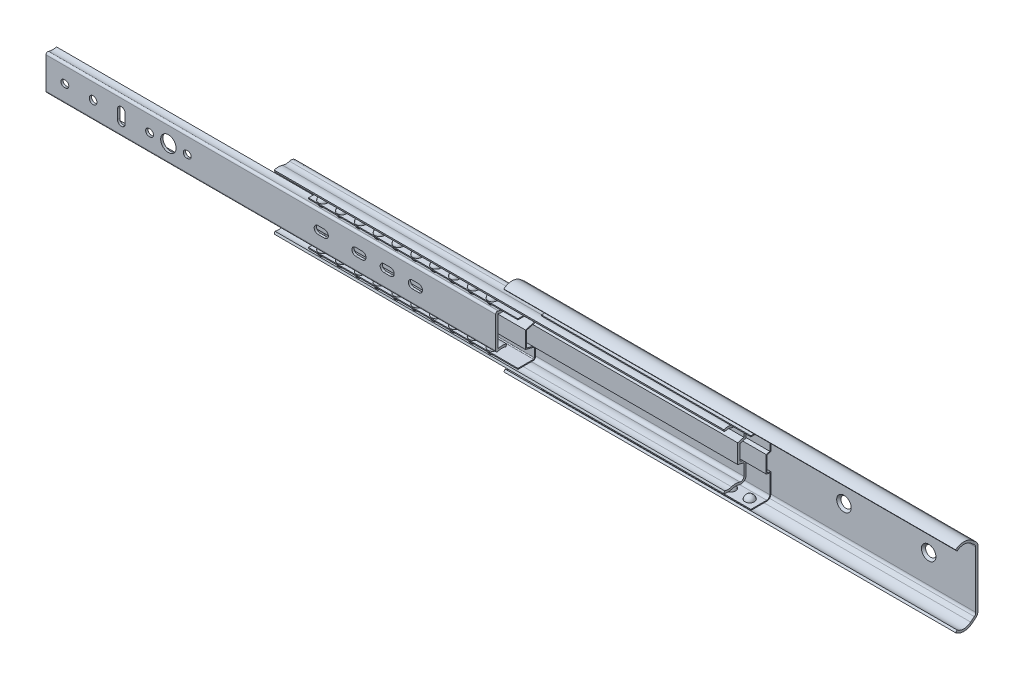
SolidWorks part; units mm, degrees
ref_plane "Front" through (0, 0, 0) normal (0, 0, 1) x (1, 0, 0)
ref_plane "Top" through (0, 0, 0) normal (0, 1, 0) x (1, 0, 0)
ref_plane "Right" through (0, 0, 0) normal (1, 0, 0) x (0, 0, -1)
sketch "Sketch1" plane through (0, 0, 0) normal (1, 0, 0) x (0, 0, -1)
  line L0 (9.525, -19.05) -> (9.525, 19.05)
  line L1 (9.525, 0) -> (-9.525, 0) construction
  line L2 (0, 0) -> (0, -26.1938) construction
  line L3 (5.5563, -24.2193) -> (8.0193, -22.2158)
  line L4 (8.001, -19.05) -> (8.001, 19.05)
  line L5 (4.5946, -23.037) -> (7.0576, -21.0335)
  line L6 (-5.5562, -24.2193) -> (-4.5946, -23.037)
  line L7 (5.5563, 24.2193) -> (8.0193, 22.2158)
  line L8 (-5.5563, 24.2193) -> (-4.5946, 23.037)
  line L9 (4.5946, 23.037) -> (7.0576, 21.0335)
  arc A0 (5.5563, -24.2193) -> (-5.5562, -24.2193) centre (0, -17.3887) cw
  arc A1 (8.0193, -22.2158) -> (9.525, -19.05) centre (5.4441, -19.05) ccw
  arc A2 (7.0576, -21.0335) -> (8.001, -19.05) centre (5.4441, -19.05) ccw
  arc A3 (4.5946, -23.037) -> (-4.5946, -23.037) centre (0, -17.3887) cw
  arc A4 (8.0193, 22.2158) -> (9.525, 19.05) centre (5.4441, 19.05) cw
  arc A5 (5.5563, 24.2193) -> (-5.5563, 24.2193) centre (0, 17.3887) ccw
  arc A6 (4.5946, 23.037) -> (-4.5946, 23.037) centre (0, 17.3887) ccw
  arc A7 (7.0576, 21.0335) -> (8.001, 19.05) centre (5.4441, 19.05) cw
  circle A8 centre (0, -21.4947) radius 3.175 construction
  point P27 (8.001, 0)
  point P29 (-9.525, 0)
  dimension "D2" = 19.05
  dimension "D7" = 11.1125
  dimension "D8" = 3.175
  dimension "D6" = 1.524
  dimension "D4" = 15.0812
  dimension "D5" = 6.35
  dimension "D1" = 38.1
  dimension "D3" = 52.3875
extrude "Extrude1" add sketch "Sketch1" along normal mid plane 304.8
ref_plane "Travel 1" through (14.2875, 0, 0) normal (1, 0, 0) x (0, 0, -1)
sketch "Sketch2" plane through (14.2875, 0, 0) normal (1, 0, 0) x (0, 0, -1)
  line L0 (4.5946, -23.037) -> (7.0576, -21.0335) construction
  line L1 (-5.5562, -21.8249) -> (7.874, -21.8249) construction
  line L2 (7.874, -21.8249) -> (7.874, -5.8433) construction
  line L3 (7.2136, -19.0492) -> (7.2136, -6.35)
  line L4 (7.874, -5.8433) -> (5.4229, -5.1865)
  line L5 (5.4229, -5.1865) -> (5.4229, 0)
  line L6 (9.525, 0) -> (-9.525, 0) construction
  line L7 (5.4229, 0) -> (5.4229, 5.1865)
  line L8 (5.4229, 5.1865) -> (7.874, 5.8433)
  line L9 (9.525, 0) -> (-9.525, 0) construction
  line L10 (8.001, -19.05) -> (8.001, 19.05) construction
  line L11 (7.874, -19.0492) -> (7.874, -5.8433)
  line L12 (5.0983, -21.825) -> (-5.5562, -21.8249)
  line L13 (4.7625, -5.6932) -> (4.7625, 0)
  line L14 (7.2136, -6.35) -> (4.7625, -5.6932)
  line L15 (7.874, 5.8433) -> (7.874, 19.0492)
  line L16 (4.7625, 0) -> (4.7625, 5.6932)
  line L17 (-5.5562, -21.8249) -> (-5.5562, -21.1646)
  line L18 (5.7825, -21.1646) -> (-5.5562, -21.1646) construction
  line L19 (7.2136, -19.7334) -> (7.2136, -6.35) construction
  line L20 (4.7625, 5.6932) -> (7.2136, 6.35)
  line L21 (7.2136, 6.35) -> (7.2136, 19.0492)
  line L22 (-5.5562, -21.1646) -> (5.0983, -21.1646)
  line L23 (-5.5562, 21.1646) -> (-5.5562, 21.8249)
  line L24 (-5.5562, 21.8249) -> (5.0983, 21.825)
  line L25 (-5.5562, 21.1646) -> (5.0983, 21.1646)
  line L27 (9.525, -19.05) -> (9.525, 19.05) construction
  arc A0 (5.0983, -21.825) -> (7.874, -19.0492) centre (5.0983, -19.0492) ccw
  arc A1 (5.0983, -21.1646) -> (7.2136, -19.0492) centre (5.0983, -19.0492) ccw
  arc A3 (7.2136, -19.7334) -> (5.7825, -21.1646) centre (7.5939, -21.5448) cw construction
  arc A4 (7.874, -19.0492) -> (5.0983, -21.825) centre (7.5939, -21.5448) cw construction
  arc A5 (7.874, 19.0492) -> (5.0983, 21.825) centre (5.0983, 19.0492) ccw
  arc A6 (7.2136, 19.0492) -> (5.0983, 21.1646) centre (5.0983, 19.0492) ccw
  dimension "D1" = 75
  dimension "D2" = 0.127
  dimension "D3" = 0.3302
  dimension "D6" = 12.7
  dimension "D4" = 0.6604
  dimension "D5" = 75
  dimension "D7" = 4.7625
extrude "Extrude2" add sketch "Sketch2" against normal blind 141.2875 separate body
ref_plane "Travel 2" through (-304.8, 0, 0) normal (-1, 0, 0) x (0, 0, 1)
sketch "Sketch3" plane through (-304.8, 0, 0) normal (-1, 0, 0) x (0, 0, 1)
  line L0 (8.001, -18.7062) -> (7.5111, -17.263)
  line L1 (-7.2136, -6.35) -> (-4.7625, -5.6932) construction
  line L3 (-7.2136, -19.0492) -> (-7.2136, -6.35) construction
  line L4 (-7.0866, -15.3051) -> (-7.0866, -6.316)
  line L6 (-7.0866, -6.316) -> (-2.8713, -5.1865)
  line L7 (-2.8713, -5.1865) -> (-2.8713, 5.1865)
  line L8 (-9.525, 0) -> (9.525, 0) construction
  line L9 (-1.3473, 6.3559) -> (-1.3473, -6.3559)
  line L10 (-1.3473, -6.3559) -> (-5.5626, -7.4854)
  line L11 (-5.5626, -7.4854) -> (-5.5626, -15.3051)
  line L13 (7.5111, 17.263) -> (8.001, 18.7062)
  line L15 (9.525, 0) -> (-9.525, 0) construction
  line L16 (-7.0866, 6.316) -> (-2.8713, 5.1865)
  line L17 (-7.0866, 15.3051) -> (-7.0866, 6.316)
  line L21 (-5.5626, 7.4854) -> (-5.5626, 15.3051)
  line L22 (-1.3473, 6.3559) -> (-5.5626, 7.4854)
  line L23 (5.5562, -21.4947) -> (9.525, -21.4947) construction
  line L24 (5.5562, -21.8249) -> (5.5562, -21.1646) construction
  line L25 (9.525, -21.4947) -> (9.525, 0) construction
  line L27 (0, 0) -> (0, -26.1938) construction
  arc A0 (2.8303, -17.263) -> (-2.8303, -17.263) centre (0, -25.6008) ccw
  arc A1 (-2.3404, -18.7062) -> (2.3404, -18.7062) centre (0, -25.6008) cw
  circle A2 centre (0, -21.4947) radius 3.175 construction
  arc A6 (2.8303, -17.263) -> (7.5111, -17.263) centre (5.1707, -10.3684) ccw
  arc A8 (2.3404, -18.7062) -> (8.001, -18.7062) centre (5.1707, -10.3684) ccw
  arc A9 (-2.3404, -18.7062) -> (-7.0866, -15.3051) centre (-3.4949, -15.3051) cw
  arc A10 (-4.5946, -23.037) -> (4.5946, -23.037) centre (0, -17.3887) ccw construction
  arc A11 (-2.8303, -17.263) -> (-5.5626, -15.3051) centre (-3.4949, -15.3051) cw
  arc A12 (-2.3404, 18.7062) -> (-7.0866, 15.3051) centre (-3.4949, 15.3051) ccw
  arc A13 (-2.3404, 18.7062) -> (2.3404, 18.7062) centre (0, 25.6008) ccw
  arc A14 (2.8303, 17.263) -> (7.5111, 17.263) centre (5.1707, 10.3684) cw
  arc A15 (2.3404, 18.7062) -> (8.001, 18.7062) centre (5.1707, 10.3684) cw
  arc A18 (2.8303, 17.263) -> (-2.8303, 17.263) centre (0, 25.6008) cw
  arc A19 (-2.8303, 17.263) -> (-5.5626, 15.3051) centre (-3.4949, 15.3051) ccw
  circle A20 centre (5.1707, -14.4744) radius 3.175 construction
  point P47 (-2.8713, 0)
  point P67 (-1.3473, 0)
  point P72 (7.5406, -21.4947)
  dimension "D1" = 1.524
  dimension "D4" = 1.524
  dimension "D2" = 1.524
  dimension "D3" = 1.524
  dimension "D6" = 0.127
extrude "Extrude3" add sketch "Sketch3" against normal blind 303.276 separate body
ref_plane "Travel 3" through (-139.6365, 0, 0) normal (1, 0, 0) x (0, 0, -1)
sketch "Sketch9" plane through (-139.6365, 0, 0) normal (-1, 0, 0) x (0, 0, 1)
  line L0 (8.763, -14.1442) -> (-1.7526, -14.1442)
  line L1 (-2.3622, -13.5346) -> (-2.3622, -7.3115)
  line L2 (-2.3622, -7.3115) -> (3.6774, -5.6932)
  line L3 (9.525, -21.4947) -> (9.525, 0) construction
  line L4 (3.6774, -5.6932) -> (3.6774, 5.6932)
  line L5 (-5.5626, -7.4854) -> (-5.5626, -15.3051) construction
  line L6 (3.017, 5.1865) -> (3.017, -5.1865)
  line L7 (-1.3473, -6.3559) -> (-5.5626, -7.4854) construction
  line L9 (-1.7526, 14.8046) -> (8.763, 14.8046)
  line L10 (3.017, -5.1865) -> (-3.0226, -6.8048)
  line L11 (9.525, 0) -> (-9.525, 0) construction
  line L12 (-3.0226, -6.8048) -> (-3.0226, -13.5346)
  line L14 (8.763, -14.1442) -> (8.763, -14.8046)
  line L15 (8.763, -14.8046) -> (-1.7526, -14.8046)
  line L16 (5.5562, -21.8249) -> (5.5562, -21.1646) construction
  line L18 (8.763, 14.8046) -> (8.763, 14.1442)
  line L19 (-3.0226, 6.8048) -> (-3.0226, 13.5346)
  line L20 (3.017, 5.1865) -> (-3.0226, 6.8048)
  line L21 (-2.3622, 7.3115) -> (3.6774, 5.6932)
  line L22 (8.763, 14.1442) -> (-1.7526, 14.1442)
  line L23 (-2.3622, 7.3115) -> (-2.3622, 13.5346)
  arc A0 (-1.7526, -14.8046) -> (-3.0226, -13.5346) centre (-1.7526, -13.5346) cw
  arc A1 (-1.7526, -14.1442) -> (-2.3622, -13.5346) centre (-1.7526, -13.5346) cw
  arc A2 (-3.0226, 13.5346) -> (-1.7526, 14.8046) centre (-1.7526, 13.5346) cw
  arc A3 (-2.3622, 13.5346) -> (-1.7526, 14.1442) centre (-1.7526, 13.5346) cw
  point P19 (8.763, -14.4744)
  point P31 (-1.3473, 0)
  point P32 (3.6774, 0)
  dimension "D6" = 1.27
  dimension "D1" = 0.6604
  dimension "D2" = 0.6604
  dimension "D3" = 0.6604
  dimension "D4" = 0.762
  dimension "D5" = 2.54
extrude "Extrude5" add sketch "Sketch9" along normal blind 141.2875 separate body
ref_plane "Travel 4" through (-457.2, 0, 0) normal (-1, 0, 0) x (0, 0, 1)
sketch "Sketch10" plane through (-457.2, 0, 0) normal (1, 0, 0) x (0, 0, -1)
  line L0 (-9.525, -10.6051) -> (-9.525, 10.6051)
  line L1 (-9.525, -21.4947) -> (-9.525, 0) construction
  line L2 (9.525, 0) -> (-9.525, 0) construction
  line L3 (-8.001, 10.2427) -> (-8.001, -10.2427)
  line L4 (-2.5445, -11.7896) -> (-1.9948, -10.3681)
  line L6 (-2.5445, 11.7896) -> (-1.9948, 10.3681)
  line L20 (-9.525, 0) -> (9.525, 0) construction
  arc A0 (-2.5445, -11.7896) -> (-7.7969, -11.7896) centre (-5.1707, -18.5805) ccw
  arc A1 (-7.7969, -11.7896) -> (-9.525, -10.6051) centre (-8.255, -10.6051) cw
  circle A2 centre (-5.1707, -14.4744) radius 3.175 construction
  arc A4 (-7.5111, -17.263) -> (-2.8303, -17.263) centre (-5.1707, -10.3684) ccw construction
  arc A7 (-1.9948, -10.3681) -> (-8.001, -10.2427) centre (-5.1707, -18.5805) ccw
  arc A8 (-7.7969, 11.7896) -> (-9.525, 10.6051) centre (-8.255, 10.6051) ccw
  arc A9 (-2.5445, 11.7896) -> (-7.7969, 11.7896) centre (-5.1707, 18.5805) cw
  arc A10 (-1.9948, 10.3681) -> (-8.001, 10.2427) centre (-5.1707, 18.5805) cw
  point P23 (-9.525, 0)
  point P29 (-8.001, 0)
  dimension "D3" = 1.524
  dimension "D4" = 1.27
  dimension "D1" = 1.524
  dimension "D2" = 1.524
extrude "Extrude6" add sketch "Sketch10" along normal blind 303.276 separate body
sketch "Sketch5" plane through (0, 0, -9.525) normal (0, 0, -1) x (-1, 0, 0)
  line L0 (-152.4, 0) -> (152.4, 0) construction
  line L1 (-152.4, -19.05) -> (-152.4, 19.05) construction
  line L11 (152.4, -19.05) -> (152.4, 19.05) construction
  circle A8 centre (146.05, 0) radius 2.5781
  circle A18 centre (120.65, 0) radius 2.5781
  point P0 (-63.5, 0)
  point P1 (-120.65, 0)
  point P39 (63.5, 0)
  dimension "D1" = 5.1562
  dimension "D2" = 6.35
  dimension "D3" = 25.4
  dimension "D4" = 82.55
  dimension "H" = 209.55
  dimension "J" = 266.7
extrude "Cut-Extrude1" cut sketch "Sketch5" against normal through all
hole_wizard "CSK for #10 Flat Head Machine Screw1" positions "Sketch14" profile "Sketch13" countersink size "#10" standard "Ansi Inch"
sketch "Sketch14" plane through (0, 0, -8.001) normal (0, 0, 1) x (1, 0, 0)
  point P0 (120.65, 0)
  point P4 (63.5, 0)
  point P7 (-63.5, 0)
sketch "Sketch13" plane through (120.65, 0, -8.001) normal (1, 0, 0) x (0, -1, 0)
  line L0 (0, 0) -> (0, 1.524)
  line L1 (0, 1.524) -> (3.048, 1.524)
  line L2 (3.048, 1.524) -> (3.048, 2.1184)
  line L3 (3.048, 2.1184) -> (4.8895, 0)
  line L5 (4.8895, 0) -> (0, 0)
  line L6 (-3.048, 2.1184) -> (-4.8895, 0) construction
  line L11 (0, -6.35) -> (0, 107.95) construction
  dimension "Thru Hole Dia." = 6.096
  dimension "Thru Hole Depth" = 1.524
  dimension "Near C'Sink Dia." = 9.779
  dimension "Near C'Sink Angle" = 82
sketch "Sketch6" plane through (0, 0, 8.001) normal (0, 0, -1) x (-1, 0, 0)
  line L0 (457.2, 0) -> (152.4, 0) construction
  line L1 (387.731, -2.286) -> (386.969, -2.286)
  line L2 (387.731, 2.286) -> (386.969, 2.286)
  line L3 (364.617, 0) -> (359.283, 0) construction
  line L4 (390.017, 0) -> (384.683, 0) construction
  line L5 (387.35, -2.286) -> (387.35, 2.286) construction
  line L6 (361.95, -2.286) -> (361.95, 2.286) construction
  line L9 (276.2885, 0) -> (266.7635, 0) construction
  line L11 (457.2, -10.2427) -> (457.2, 10.2427) construction
  line L17 (406.4, -5.7531) -> (406.4, 5.7531) construction
  line L19 (273.7096, -2.5789) -> (269.3424, -2.5789)
  line L20 (273.7096, 2.5789) -> (269.3424, 2.5789)
  line L21 (271.526, -2.5789) -> (271.526, 2.5789) construction
  line L22 (248.3096, -2.5789) -> (243.9424, -2.5789)
  line L23 (444.5, -2.286) -> (444.5, 2.286) construction
  line L24 (447.167, 0) -> (441.833, 0) construction
  line L25 (444.881, -2.286) -> (444.119, -2.286)
  line L26 (444.881, 2.286) -> (444.119, 2.286)
  line L27 (248.3096, 2.5789) -> (243.9424, 2.5789)
  line L28 (246.126, -2.5789) -> (246.126, 2.5789) construction
  line L29 (229.2596, -2.5789) -> (224.8924, -2.5789)
  line L30 (362.331, -2.286) -> (361.569, -2.286)
  line L31 (362.331, 2.286) -> (361.569, 2.286)
  line L32 (229.2596, 2.5789) -> (224.8924, 2.5789)
  line L33 (227.076, -2.5789) -> (227.076, 2.5789) construction
  line L34 (408.9781, -3.175) -> (408.9781, 3.175)
  line L35 (403.8219, -3.175) -> (403.8219, 3.175)
  line L36 (210.2096, -2.5789) -> (205.8424, -2.5789)
  line L37 (210.2096, 2.5789) -> (205.8424, 2.5789)
  line L38 (208.026, -2.5789) -> (208.026, 2.5789) construction
  arc A0 (444.881, -2.286) -> (444.881, 2.286) centre (444.881, 0) ccw
  arc A1 (387.731, -2.286) -> (387.731, 2.286) centre (387.731, 0) ccw
  arc A2 (386.969, -2.286) -> (386.969, 2.286) centre (386.969, 0) cw
  arc A3 (362.331, -2.286) -> (362.331, 2.286) centre (362.331, 0) ccw
  circle A6 centre (374.65, 0) radius 5.207
  arc A9 (408.9781, -3.175) -> (403.8219, -3.175) centre (406.4, -3.175) cw
  circle A10 centre (425.45, 0) radius 2.5781
  arc A12 (444.119, -2.286) -> (444.119, 2.286) centre (444.119, 0) cw
  arc A13 (361.569, -2.286) -> (361.569, 2.286) centre (361.569, 0) cw
  arc A14 (408.9781, 3.175) -> (403.8219, 3.175) centre (406.4, 3.175) ccw
  arc A16 (273.7096, -2.5789) -> (273.7096, 2.5789) centre (273.7096, 0) ccw
  arc A17 (269.3424, -2.5789) -> (269.3424, 2.5789) centre (269.3424, 0) cw
  arc A18 (248.3096, -2.5789) -> (248.3096, 2.5789) centre (248.3096, 0) ccw
  arc A19 (243.9424, -2.5789) -> (243.9424, 2.5789) centre (243.9424, 0) cw
  arc A20 (229.2596, -2.5789) -> (229.2596, 2.5789) centre (229.2596, 0) ccw
  arc A21 (224.8924, -2.5789) -> (224.8924, 2.5789) centre (224.8924, 0) cw
  arc A22 (210.2096, -2.5789) -> (210.2096, 2.5789) centre (210.2096, 0) ccw
  arc A23 (205.8424, -2.5789) -> (205.8424, 2.5789) centre (205.8424, 0) cw
  point P6 (387.35, 0)
  point P51 (406.4, 0)
  point P67 (444.5, 0)
  point P76 (361.95, 0)
  dimension "D1" = 5.1562
  dimension "D10" = 10.414
  dimension "D2" = 4.572
  dimension "D3" = 5.334
  dimension "D4" = 12.7
  dimension "D5" = 31.75
  dimension "D6" = 11.5062
  dimension "D" = 153.924
  dimension "E" = 179.324
  dimension "D7" = 5.1562
  dimension "D8" = 19.05
  dimension "D9" = 38.1
  dimension "D11" = 50.8
  dimension "D12" = 63.5
  dimension "D13" = 9.525
  dimension "D14" = 5.1579
  dimension "F" = 198.374
  dimension "G" = 217.424
extrude "Cut-Extrude2" cut sketch "Sketch6" against normal through all
ref_plane "Plane1" through (7.9375, 0, 0) normal (1, 0, 0) x (0, 0, -1)
sketch "Sketch8" plane through (7.9375, 0, 0) normal (1, 0, 0) x (0, 0, -1)
  line L0 (-3.175, -21.4947) -> (3.175, -21.4947)
  circle A0 centre (0, -21.4947) radius 3.175 construction
  arc A1 (-3.175, -21.4947) -> (3.175, -21.4947) centre (0, -21.4947) ccw
revolve "Revolve1" add sketch "Sketch8" angle 360 about L0
pattern_linear "LPattern2" count 10 spacing 12.7 along (-1, 0, 0) of "Revolve1"
mirror "Mirror2" about plane through (0, 0, 0) normal (0, 1, 0) of "LPattern2", "Revolve1"
ref_plane "Plane2" through (-274.574, 0, 0) normal (-1, 0, 0) x (0, 0, 1)
sketch "Sketch12" plane through (-274.574, 0, 0) normal (-1, 0, 0) x (0, 0, 1)
  line L0 (8.3457, -14.4744) -> (1.9957, -14.4744)
  circle A0 centre (5.1707, -14.4744) radius 3.175 construction
  arc A2 (8.3457, -14.4744) -> (1.9957, -14.4744) centre (5.1707, -14.4744) ccw
  circle A3 centre (5.1707, -14.4744) radius 3.175 construction
revolve "Revolve2" add sketch "Sketch12" angle 360 about L0
pattern_linear "LPattern3" count 10 spacing 12.7 along (1, 0, 0) of "Revolve2"
mirror "Mirror3" about plane through (0, 0, 0) normal (0, 1, 0) of "LPattern3", "Revolve2"
equation "\"D1@Extrude3\" = \"D1@Extrude1\"-0.06"
equation "\"D1@Extrude5\" = \"D1@Extrude2\""
equation "\"D1@Extrude6\" = \"D1@Extrude3\""
equation "\"D1@Plane2\" = \"D1@Plane1\""
equation "\"D3@LPattern3\" = \"D3@LPattern2\""
